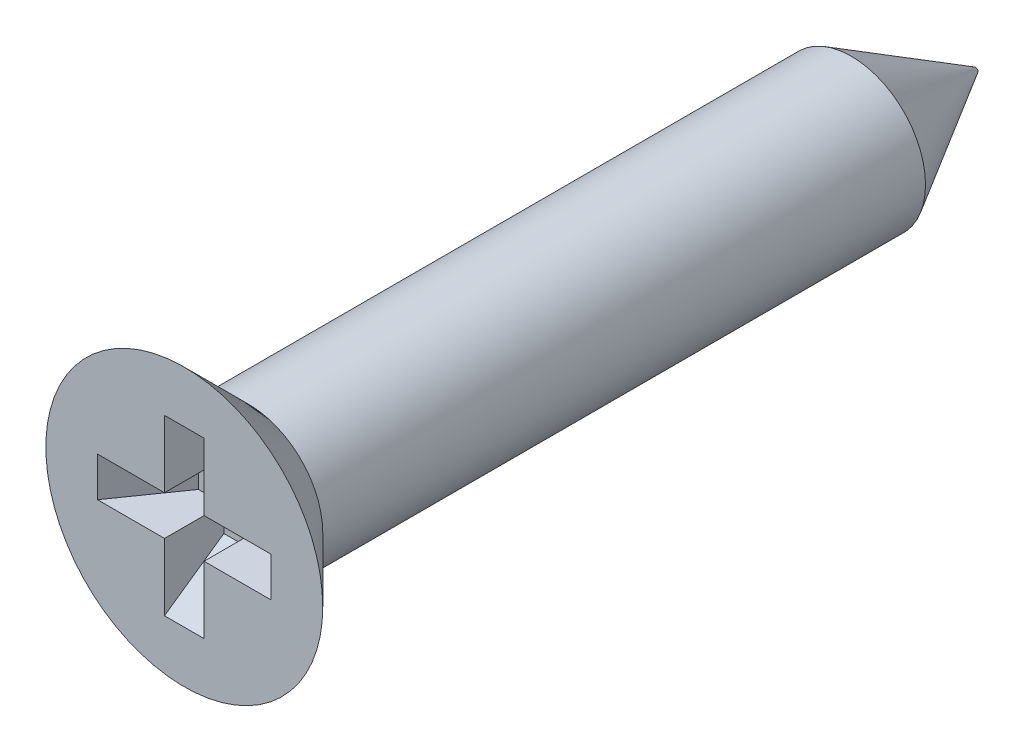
SolidWorks part; units mm, degrees
ref_plane "Plan de face" through (0, 0, 0) normal (0, 0, 1) x (1, 0, 0)
ref_plane "Plan de dessus" through (0, 0, 0) normal (0, 1, 0) x (1, 0, 0)
ref_plane "Plan de droite" through (0, 0, 0) normal (1, 0, 0) x (0, 0, -1)
sketch "Esquisse1" plane through (0, 0, 0) normal (1, 0, 0) x (0, 0, -1)
  line L0 (-1.6035, 0) -> (7.1529, 0) construction
  line L1 (0, 5.0438) -> (0, -4.594) construction
  line L2 (0, 2.8) -> (1.3, 1.5)
  line L3 (1.3, 1.5) -> (1.3, 0)
  line L4 (-1.442, 2.8) -> (2.7621, 2.8) construction
  line L5 (0, 2.8) -> (8.0274, -5.2274) construction
  line L6 (-1.0988, 1.5) -> (4.1029, 1.5) construction
  line L7 (1.3, 0) -> (0, 0)
  line L9 (0, 2.8) -> (0, 0)
revolve "Révolution2" add sketch "Esquisse1" angle 360 about L0
sketch "Esquisse3" plane through (0, 0, 0) normal (0, 0, 1) x (1, 0, 0)
  circle A0 centre (0, 0) radius 1.5
extrude "Extrusion1" add sketch "Esquisse3" against normal blind 16
sketch "Esquisse2" plane through (0, 0, 0) normal (0, 0, 1) x (1, 0, 0)
  line L0 (0.4, -0.4) -> (1.755, -0.4)
  line L1 (0.4, 0.4) -> (1.755, 0.4)
  line L2 (-1.755, -0.4) -> (-0.4, -0.4)
  line L3 (-0.4, 1.755) -> (-0.4, 0.4)
  line L4 (-1.755, 0.4) -> (-0.4, 0.4)
  line L5 (0.4, 1.755) -> (0.4, 0.4)
  line L6 (-0.4, 1.755) -> (0.4, 1.755)
  line L7 (1.755, 0.4) -> (1.755, -0.4)
  line L8 (0.4, -1.755) -> (-0.4, -1.755)
  line L9 (-1.755, -0.4) -> (-1.755, 0.4)
  line L10 (-0.4, -0.4) -> (-0.4, -1.755)
  line L12 (0.4, -0.4) -> (0.4, -1.755)
  circle A0 centre (0, 0) radius 1.8 construction
extrude "Enlèv. mat.-Extru.2" cut sketch "Esquisse2" against normal blind 1.2
draft "Dépouille3" type of draft neutral plane draft angle 35 faces to draft 4 parameters "D1"=35
chamfer "Chanfrein1" distance 1.45 angle 60 1 edges at (1.5, 0, -16)
